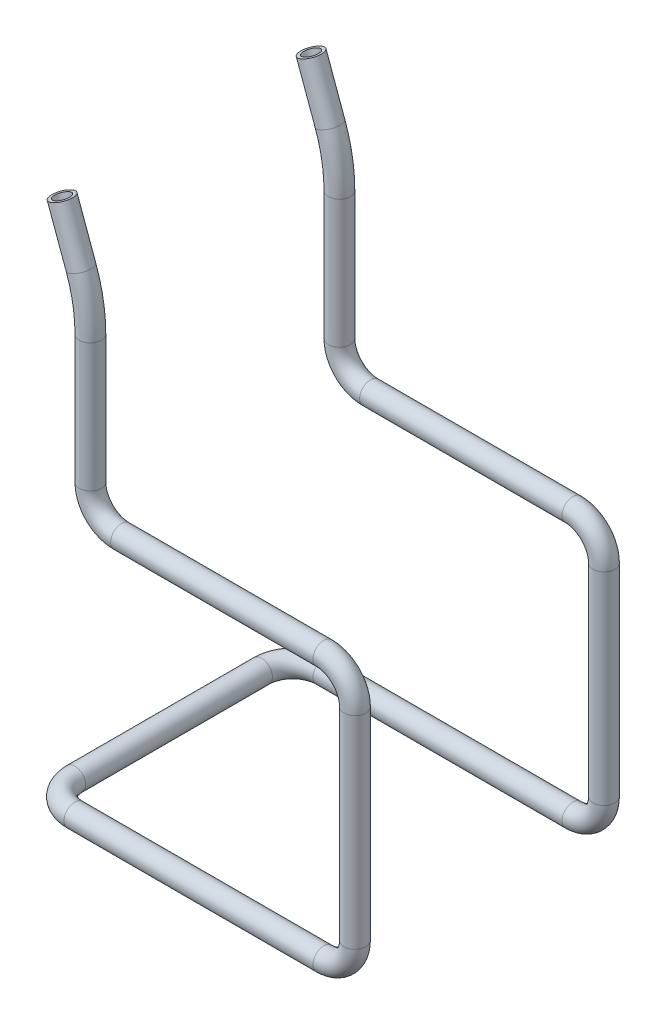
SolidWorks part; units mm, degrees
ref_plane "Front" through (0, 0, 0) normal (0, 0, 1) x (1, 0, 0)
ref_plane "Top" through (0, 0, 0) normal (0, 1, 0) x (1, 0, 0)
ref_plane "Right" through (0, 0, 0) normal (1, 0, 0) x (0, 0, -1)
sketch3d "3DSketch1"
  line L0 (0, 0, 0) -> (0, 0, 30)
  line L1 (10, 0, 40) -> (90, 0, 40)
  line L2 (100, 10, 40) -> (100, 75, 40)
  line L3 (90, 85, 40) -> (25, 85, 40)
  line L4 (15, 95, 40) -> (15, 136.1837, 40)
  line L5 (11.9846, 153.2847, 40) -> (5.9007, 170, 40)
  arc A0 (10, 0, 40) -> (0, 0, 30) centre (10, 0, 30) ccw
  arc A1 (100, 10, 40) -> (90, 0, 40) centre (90, 10, 40) ccw
  arc A2 (90, 85, 40) -> (100, 75, 40) centre (90, 75, 40) ccw
  arc A3 (15, 95, 40) -> (25, 85, 40) centre (25, 95, 40) ccw
  arc A4 (11.9846, 153.2847, 40) -> (15, 136.1837, 40) centre (-35, 136.1837, 40) ccw
  point P9 (0, 0, 40)
  point P11 (10, -10, 30)
  point P14 (100, 0, 40)
  point P15 (90, 10, 30)
  point P18 (100, 85, 40)
  point P19 (90, 75, 30)
  point P22 (15, 85, 40)
  point P23 (25, 95, 50)
  point P26 (15, 145, 40)
  point P27 (-35, 136.1837, -10)
  dimension "D8" = 40
  dimension "D9" = 10
  dimension "D10" = 10
  dimension "D11" = 10
  dimension "D12" = 50
  dimension "D13" = 10
  dimension "D2" = 100
  dimension "D3" = 85
  dimension "D4" = 85
  dimension "D5" = 170
  dimension "D6" = 20
  dimension "D7" = 60
sketch "Sketch1" plane through (0, 0, 0) normal (0, 0, 1) x (1, 0, 0)
  circle A0 centre (0, 0) radius 2.5
  dimension "D1" = 5
sweep "Sweep-Thin1" add profiles "Sketch1" path "3DSketch1" parameters "D1"=1
mirror "Mirror3" about plane through (0, 0, 0) normal (0, 0, 1)
